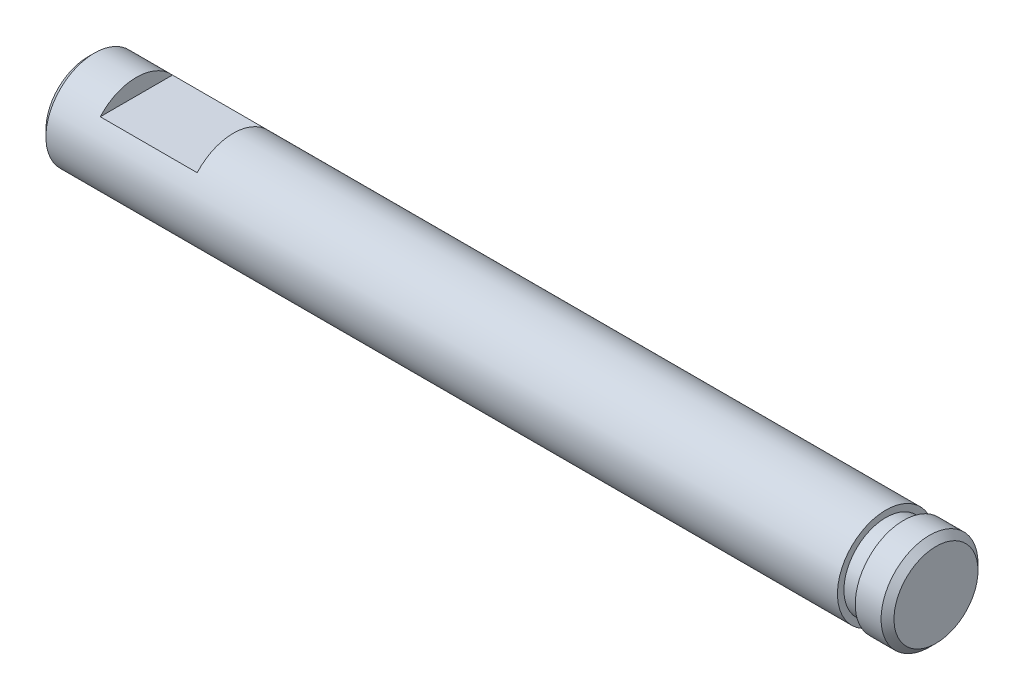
SolidWorks part; units mm, degrees
ref_plane "Plano frontal" through (0, 0, 0) normal (0, 0, 1) x (1, 0, 0)
ref_plane "Plano superior" through (0, 0, 0) normal (0, 1, 0) x (1, 0, 0)
ref_plane "Plano direito" through (0, 0, 0) normal (1, 0, 0) x (0, 0, -1)
sketch "Esboço1" plane through (0, 0, 0) normal (0, 0, 1) x (1, 0, 0)
  line L0 (0, 0) -> (0, 1.3)
  line L1 (0.2, 1.5) -> (24.7, 1.5)
  line L2 (24.7, 1.5) -> (24.7, 1.3)
  line L3 (24.7, 1.3) -> (25.25, 1.3)
  line L4 (25.25, 1.3) -> (25.25, 1.5)
  line L5 (25.25, 1.5) -> (26.05, 1.5)
  line L6 (26.25, 1.3) -> (26.25, 0)
  line L7 (26.25, 0) -> (0, 0) construction
  line L8 (0, 1.3) -> (0.2, 1.5)
  line L9 (26.05, 1.5) -> (26.25, 1.3)
  line L10 (0, 0) -> (26.25, 0)
  point P1 (0, 1.5)
  point P8 (26.25, 1.5)
  dimension "D1" = 26.25
  dimension "D2" = 1
  dimension "D3" = 0.55
  dimension "D4" = 3
  dimension "D5" = 2.6
revolve "Revolução1" add sketch "Esboço1" angle 360 about L7
sketch "Esboço2" plane through (0, 0, 0) normal (0, 0, 1) x (1, 0, 0)
  line L0 (24.7, 1.5) -> (0.2, 1.5) construction
  line L1 (1.5, 1.5) -> (4.5, 1.5)
  line L2 (1.5, 1.5) -> (1.5, 1)
  line L3 (1.5, 1) -> (4.5, 1)
  line L4 (4.5, 1.5) -> (4.5, 1)
  line L5 (0, 1.3) -> (0, -1.3) construction
  dimension "D1" = 3
  dimension "D2" = 0.5
  dimension "D3" = 1.5
extrude "Corte-extrusão1" cut sketch "Esboço2" against normal through all both and the other way through all
